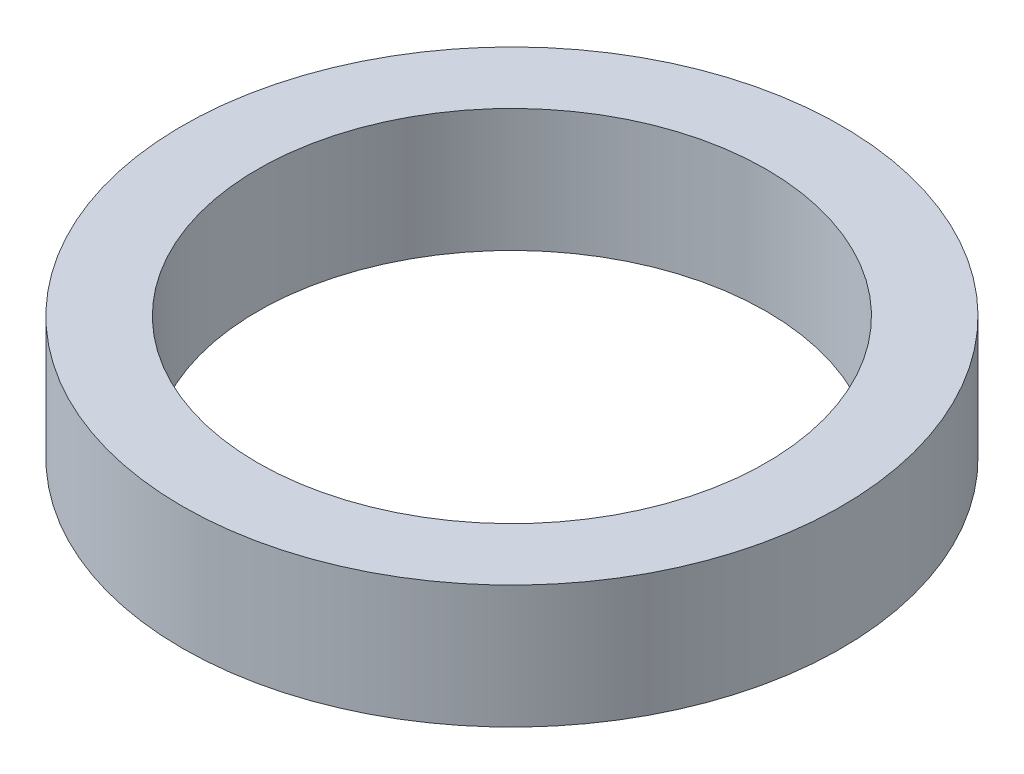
SolidWorks part; units mm, degrees
ref_plane "Front Plane" through (0, 0, 0) normal (0, 0, 1) x (1, 0, 0)
ref_plane "Top Plane" through (0, 0, 0) normal (0, 1, 0) x (1, 0, 0)
ref_plane "Right Plane" through (0, 0, 0) normal (1, 0, 0) x (0, 0, -1)
sketch "Sketch1" plane through (0, 0, 0) normal (0, 1, 0) x (1, 0, 0)
  circle A0 centre (0, 0) radius 10.13
  circle A1 centre (0, 0) radius 13.13
  dimension "D1" = 20.26
  dimension "D2" = 3
extrude "Boss-Extrude1" add sketch "Sketch1" along normal blind 4.9
